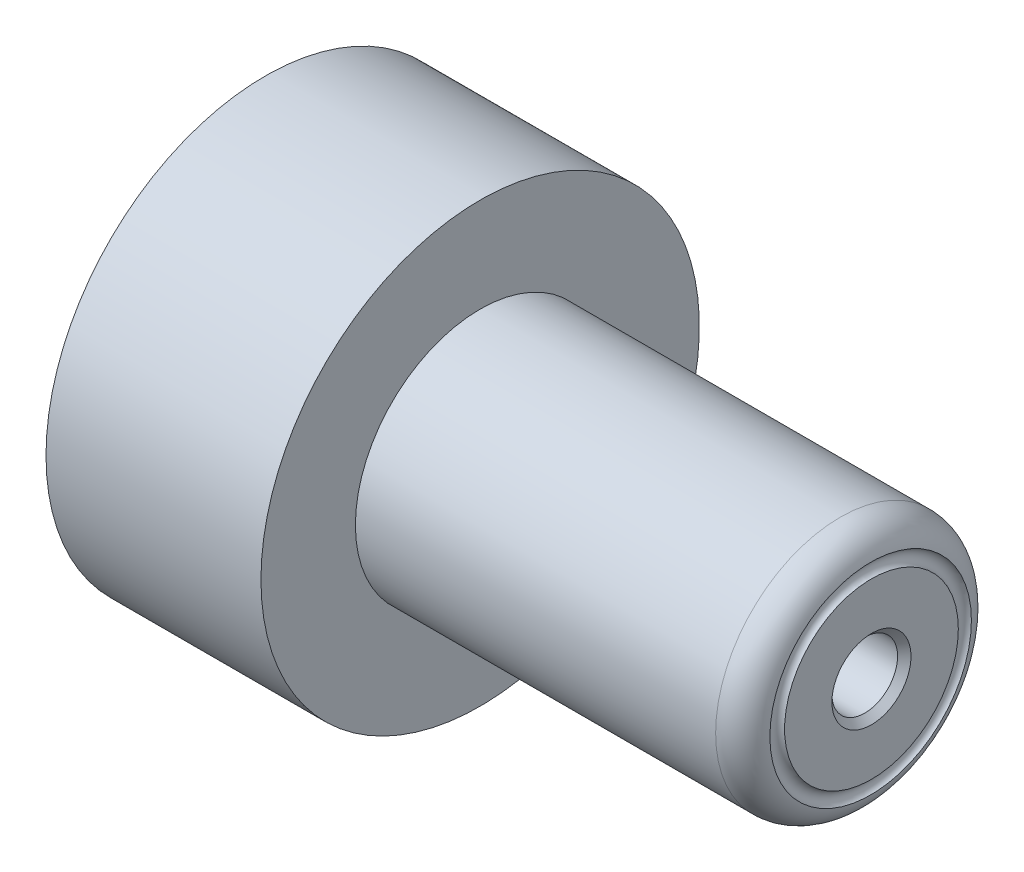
SolidWorks part; units mm, degrees
ref_plane "Front Plane" through (0, 0, 0) normal (0, 0, 1) x (1, 0, 0)
ref_plane "Top Plane" through (0, 0, 0) normal (0, 1, 0) x (1, 0, 0)
ref_plane "Right Plane" through (0, 0, 0) normal (1, 0, 0) x (0, 0, -1)
sketch "Sketch1" plane through (0, 0, 0) normal (0, 0, 1) x (1, 0, 0)
  line L0 (0, 0) -> (102.3864, 0) construction
  line L1 (0, 3.9751) -> (0, 11.1125)
  line L2 (0, 11.1125) -> (10.8966, 11.1125)
  line L3 (10.8966, 11.1125) -> (10.8966, 6.3246)
  line L4 (10.8966, 6.3246) -> (29.1592, 6.3246)
  line L5 (30.734, 4.7498) -> (30.734, 0)
  line L6 (30.734, 0) -> (21.8948, 0)
  line L7 (0, 3.9751) -> (21.8948, 3.9751)
  line L8 (21.8948, 3.9751) -> (21.8948, 0)
  arc A0 (30.734, 4.7498) -> (29.1592, 6.3246) centre (29.1592, 4.7498) ccw
  dimension "D5" = 1.5748
  dimension "D1" = 10.8966
  dimension "D2" = 22.225
  dimension "D3" = 21.8948
  dimension "D4" = 7.9502
  dimension "D6" = 30.734
  dimension "D7" = 12.6492
revolve "Revolve1" add sketch "Sketch1" angle 360 about L0
sketch "Sketch2" plane through (0, 0, 0) normal (-1, 0, 0) x (0, 0, 1)
  line L0 (0, 0) -> (0, 9.7644) construction
  circle A0 centre (-6.7437, 0) radius 1.2065
  circle A1 centre (6.7437, 0) radius 1.2065
  dimension "D2" = 2.413
  dimension "D1" = 13.4874
extrude "Cut-Extrude1" cut sketch "Sketch2" against normal blind 2.54
sketch "Sketch3" plane through (30.734, 0, 0) normal (1, 0, 0) x (0, 0, -1)
  circle A0 centre (0, 0) radius 1.665
  dimension "D1" = 3.33
extrude "Cut-Extrude2" cut sketch "Sketch3" against normal through all
chamfer "Chamfer1" distance 0.34 angle 45 1 edges at (30.734, 0, -1.665)
sketch "Sketch4" plane through (0, 0, 0) normal (0, 0, 1) x (1, 0, 0)
  line L0 (0, 0) -> (35.115, 0) construction
  line L1 (0, 11.1125) -> (0, -11.1125) construction
  circle A0 centre (30.857, 4.765) radius 0.381
  dimension "D1" = 0.762
  dimension "D3" = 30.857
  dimension "D2" = 4.765
revolve "Cut-Revolve1" cut sketch "Sketch4" angle 360 about L0
